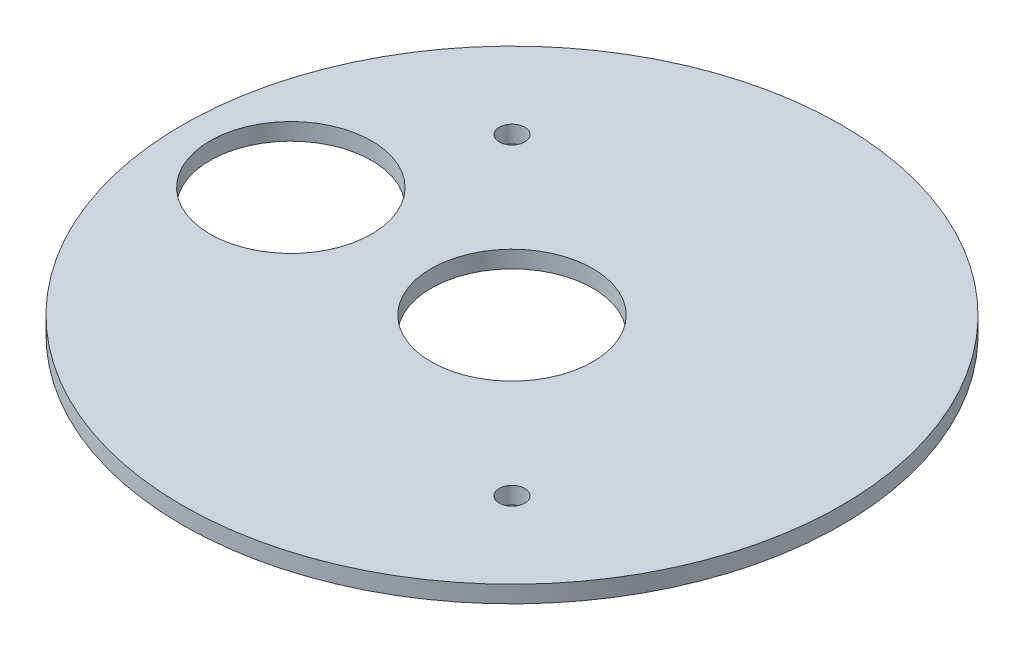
SolidWorks part; units mm, degrees
ref_plane "Front Plane" through (0, 0, 0) normal (0, 0, 1) x (1, 0, 0)
ref_plane "Top Plane" through (0, 0, 0) normal (0, 1, 0) x (1, 0, 0)
ref_plane "Right Plane" through (0, 0, 0) normal (1, 0, 0) x (0, 0, -1)
sketch "Sketch1" plane through (0, 0, 0) normal (0, 1, 0) x (1, 0, 0)
  circle A0 centre (0, 0) radius 123
  dimension "D1" = 246
extrude "Boss-Extrude1" add sketch "Sketch1" along normal blind 6.35
sketch "Sketch2" plane through (0, 6.35, 0) normal (0, 1, 0) x (1, 0, 0)
  line L0 (0, 0) -> (-82.55, 0) construction
  circle A0 centre (0, 0) radius 30.1625
  circle A1 centre (-82.55, 0) radius 30.1625
  dimension "D1" = 60.325
  dimension "D2" = 82.55
extrude "Cut-Extrude1" cut sketch "Sketch2" against normal through all
sketch "Sketch3" plane through (0, 6.35, 0) normal (0, 1, 0) x (1, 0, 0)
  line L0 (0, 0) -> (86.9741, -86.9741) construction
  line L1 (0, 0) -> (0, 123) construction
  circle A0 centre (0, 0) radius 123 construction
  circle A1 centre (58.3717, -58.3717) radius 4.7625
  circle A2 centre (-58.3717, 58.3717) radius 4.7625
  point P12 (0, 0)
  dimension "D1" = 9.525
  dimension "D3" = 82.55
  dimension "D2" = 135
  dimension "D4" = 2
extrude "Cut-Extrude2" cut sketch "Sketch3" against normal up to next
